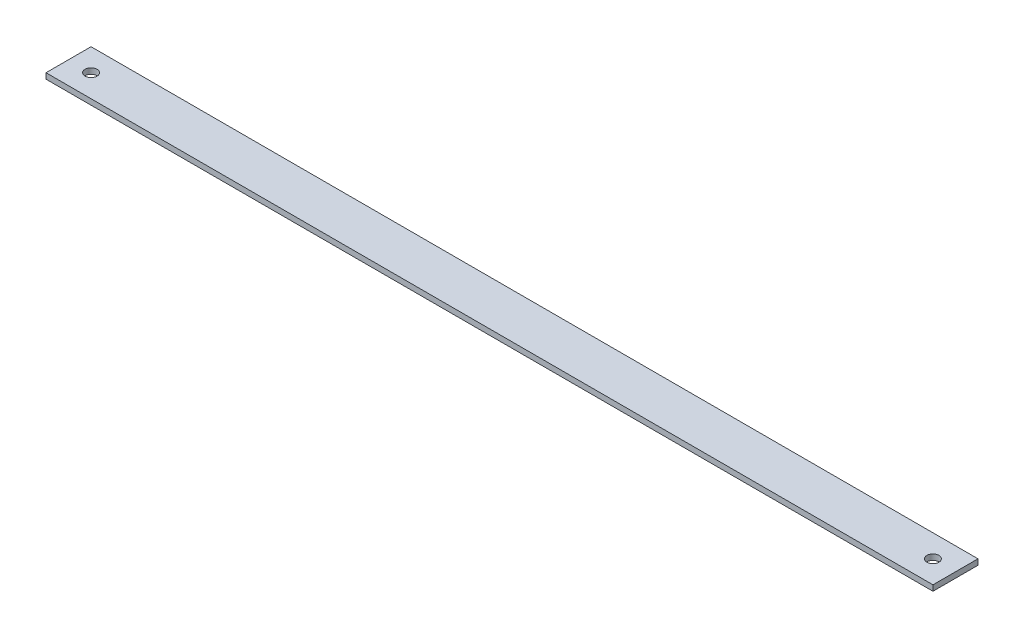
SolidWorks part; units mm, degrees
ref_plane "Front Plane" through (0, 0, 0) normal (0, 0, 1) x (1, 0, 0)
ref_plane "Top Plane" through (0, 0, 0) normal (0, 1, 0) x (1, 0, 0)
ref_plane "Right Plane" through (0, 0, 0) normal (1, 0, 0) x (0, 0, -1)
sketch "Sketch1" plane through (0, 0, 0) normal (0, 1, 0) x (1, 0, 0)
  line L1 (-250.063, 12.7) -> (250.063, 12.7)
  line L2 (-250.063, 12.7) -> (-250.063, -12.7)
  line L3 (-250.063, -12.7) -> (250.063, -12.7)
  line L4 (250.063, 12.7) -> (250.063, -12.7)
  line L5 (-250.063, 12.7) -> (250.063, -12.7) construction
  line L6 (-250.063, -12.7) -> (250.063, 12.7) construction
  point P0 (0, 0)
  dimension "D1" = 500.126
  dimension "D2" = 25.4
extrude "Boss-Extrude1" add sketch "Sketch1" along normal blind 3.175
sketch "Sketch3" plane through (0, 3.175, 0) normal (0, 1, 0) x (1, 0, 0)
  line L0 (-250.063, 0) -> (250.063, 0) construction
  line L1 (-250.063, 12.7) -> (-250.063, -12.7) construction
  line L2 (250.063, -12.7) -> (250.063, 12.7) construction
  line L3 (-250.063, -12.7) -> (250.063, -12.7) construction
  line L4 (-250.063, 12.7) -> (-250.063, -12.7) construction
  line L7 (250.063, -12.7) -> (250.063, 12.7) construction
  circle A0 centre (-237.363, 0) radius 3.3782
  circle A2 centre (237.363, 0) radius 3.3782
  dimension "D3" = 6.7564
  dimension "D4" = 6.7564
  dimension "D5" = 12.7
  dimension "D1" = 12.7
  dimension "D6" = 12.7
extrude "Cut-Extrude1" cut sketch "Sketch3" against normal through all
